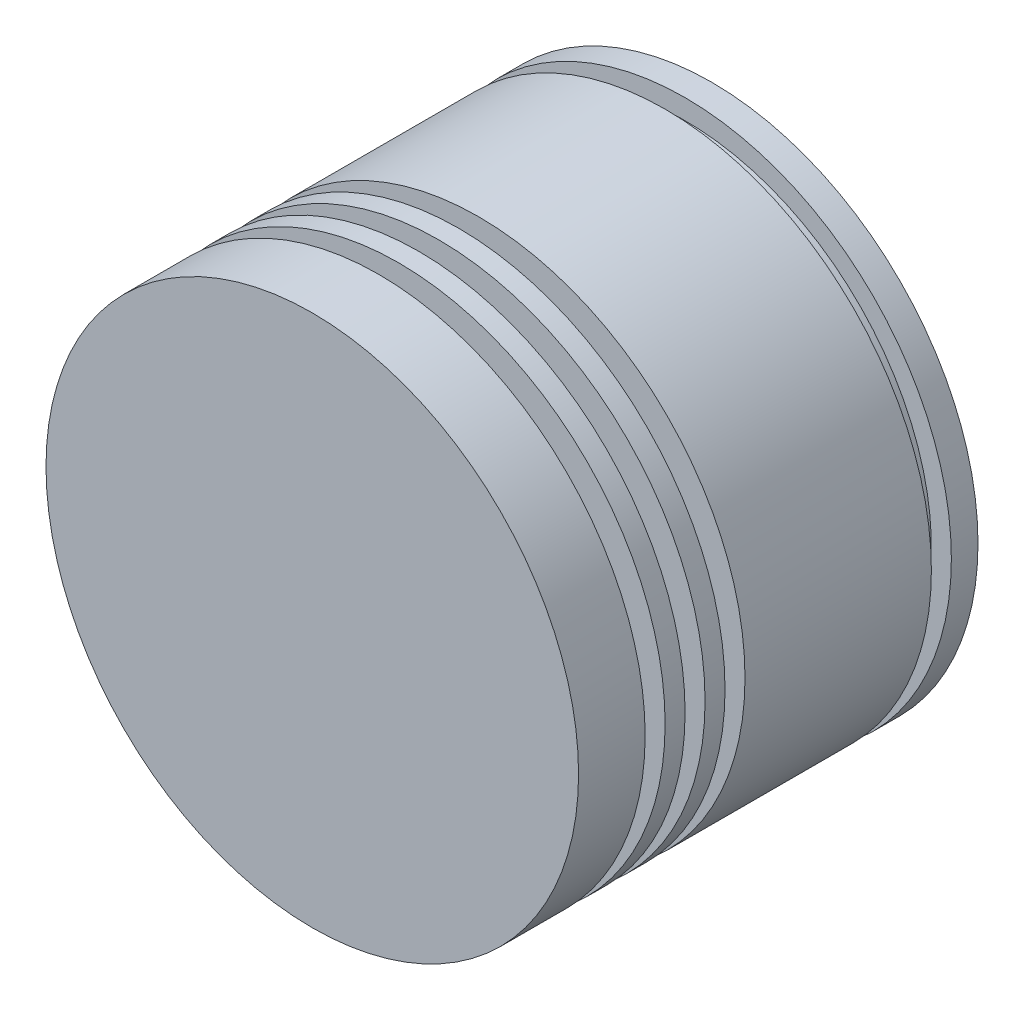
SolidWorks part; units mm, degrees
ref_plane "Ebene vorne" through (0, 0, 0) normal (0, 0, 1) x (1, 0, 0)
ref_plane "Ebene oben" through (0, 0, 0) normal (0, 1, 0) x (1, 0, 0)
ref_plane "Ebene rechts" through (0, 0, 0) normal (1, 0, 0) x (0, 0, -1)
sketch "Skizze1" plane through (0, 0, 0) normal (0, 0, 1) x (1, 0, 0)
  circle A0 centre (0, 0) radius 40
  dimension "D1" = 80
extrude "Linear austragen1" add sketch "Skizze1" against normal blind 60
sketch "Skizze2" plane through (0, 0, 0) normal (0, 0, 1) x (1, 0, 0)
  circle A0 centre (0, 0) radius 35
  circle A3 centre (0, 0) radius 40 construction
  dimension "D1" = 5
extrude "Schnitt-Linear austragen2" cut sketch "Skizze2" against normal blind 3 from offset 10 flip side to cut
pattern_linear "Lineares Muster1" count 3 spacing 6 along (0, 0, -1) of "Schnitt-Linear austragen2"
sketch "Skizze3" plane through (0, 0, 0) normal (0, 1, 0) x (1, 0, 0)
  line L1 (-42, 56) -> (-37, 56)
  line L2 (-42, 56) -> (-42, 53)
  line L3 (-42, 53) -> (-37, 53)
  line L4 (-37, 56) -> (-37, 53)
  line L5 (-40, 60) -> (-40, 25) construction
  line L6 (40, 60) -> (-40, 60) construction
  dimension "D1" = 3
  dimension "D2" = 3
  dimension "D3" = 4
  dimension "D4" = 5
revolve "Schnitt-Rotation1" cut sketch "Skizze3" angle 360 about axis through (0, 0, -60) along (0, 0, 1)
equation "\"LÄNGE\"=0"
equation "\"BREITE\"=0"
equation "\"HÖHE\"=0"
equation "\"DURCHMESSER\"=0"
equation "\"Stückzahl\"= 1"
